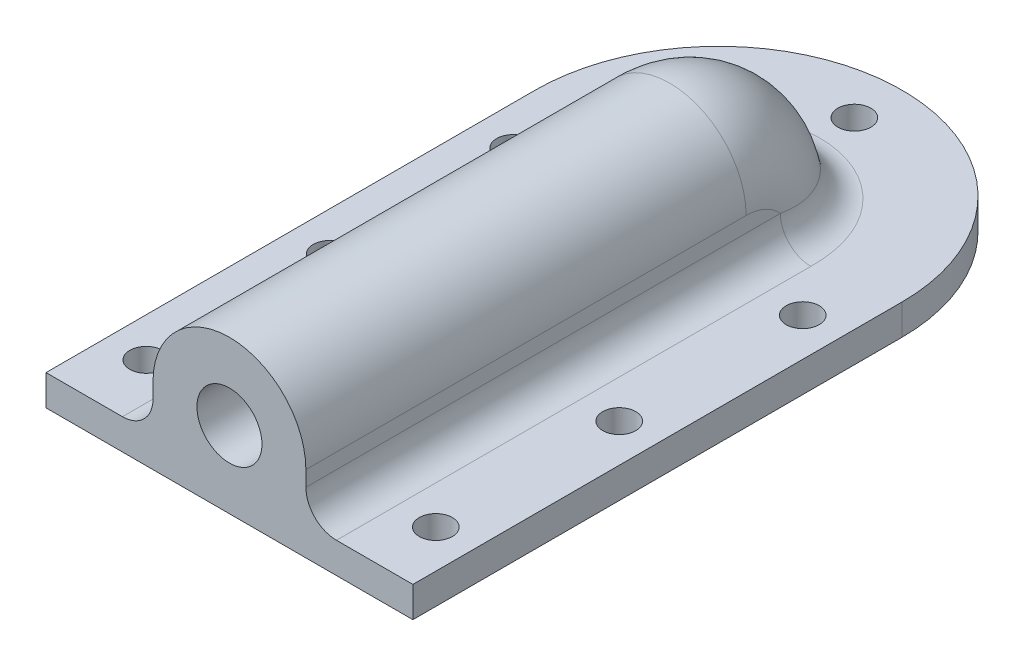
SolidWorks part; units mm, degrees
ref_plane "Front Plane" through (0, 0, 0) normal (0, 0, 1) x (1, 0, 0)
ref_plane "Top Plane" through (0, 0, 0) normal (0, 1, 0) x (1, 0, 0)
ref_plane "Right Plane" through (0, 0, 0) normal (1, 0, 0) x (0, 0, -1)
sketch "Sketch2" plane through (0, 0, 0) normal (0, 1, 0) x (1, 0, 0)
  line L2 (-19.05, 25.4) -> (-19.05, -25.4)
  line L3 (-19.05, -25.4) -> (19.05, -25.4)
  line L4 (19.05, 25.4) -> (19.05, -25.4)
  line L5 (-19.05, 25.4) -> (19.05, -25.4) construction
  line L6 (-19.05, -25.4) -> (19.05, 25.4) construction
  arc A0 (19.05, 25.4) -> (-19.05, 25.4) centre (0, 25.4) ccw
  point P0 (0, 0)
  dimension "D1" = 38.1
  dimension "D2" = 50.8
extrude "Boss-Extrude1" add sketch "Sketch2" along normal blind 3.175
sketch "Sketch3" plane through (0, 0, 25.4) normal (0, 0, 1) x (1, 0, 0)
  line L0 (-7.9375, 7.9375) -> (-7.9375, 3.175)
  line L1 (-19.05, 3.175) -> (19.05, 3.175) construction
  line L2 (7.9375, 7.9375) -> (7.9375, 3.175)
  line L3 (7.9375, 3.175) -> (-7.9375, 3.175)
  circle A0 centre (0, 7.9375) radius 3.377
  arc A1 (7.9375, 7.9375) -> (-7.9375, 7.9375) centre (0, 7.9375) ccw
  dimension "D1" = 6.754
  dimension "D2" = 7.9375
extrude "Boss-Extrude2" add sketch "Sketch3" against normal blind 45.72
sketch "Sketch4" plane through (0, 0, -20.32) normal (0, 0, -1) x (-1, 0, 0)
  line L0 (-7.9375, 7.9375) -> (-7.9375, 3.175)
  line L1 (19.05, 3.175) -> (-19.05, 3.175) construction
  line L2 (-7.9375, 3.175) -> (7.9375, 3.175)
  line L3 (7.9375, 3.175) -> (7.9375, 7.9375)
  arc A1 (7.9375, 7.9375) -> (-7.9375, 7.9375) centre (0, 7.9375) ccw
revolve "Revolve1" add sketch "Sketch4" angle 90 about L2
fillet "Fillet1" radius 3.175 3 edges at (0, 3.175, -33.02) (7.9375, 3.175, 0.1588) (-7.9375, 3.175, 0.1588)
sketch "Sketch5" plane through (0, 3.175, 0) normal (0, 1, 0) x (1, 0, 0)
  line L0 (-19.05, 25.4) -> (-19.05, -25.4) construction
  line L1 (-19.05, -25.4) -> (-11.1125, -25.4) construction
  line L2 (11.1125, -25.4) -> (19.05, -25.4) construction
  circle A0 centre (-14.986, -19.05) radius 1.7145
  circle A1 centre (-14.986, 0) radius 1.7145
  circle A2 centre (-14.986, 19.05) radius 1.7145
  circle A3 centre (15.0812, -19.05) radius 1.7145
  circle A4 centre (15.0812, 0) radius 1.7145
  circle A5 centre (15.0812, 19.05) radius 1.7145
  dimension "D1" = 3.429
  dimension "D2" = 3.429
  dimension "D3" = 3.429
  dimension "D9" = 3.429
  dimension "D10" = 3.429
  dimension "D11" = 3.429
  dimension "D4" = 19.05
  dimension "D5" = 19.05
  dimension "D6" = 4.064
  dimension "D7" = 4.064
  dimension "D8" = 4.064
  dimension "D12" = 6.35
  dimension "D13" = 6.35
  dimension "D14" = 19.05
  dimension "D15" = 19.05
extrude "Cut-Extrude1" cut sketch "Sketch5" against normal blind 50.8
sketch "Sketch6" plane through (0, 3.175, 0) normal (0, 1, 0) x (1, 0, 0)
  circle A0 centre (0, 39.497) radius 1.7145
  arc A1 (19.05, 25.4) -> (-19.05, 25.4) centre (0, 25.4) ccw construction
  dimension "D1" = 3.429
  dimension "D2" = 14.097
extrude "Cut-Extrude2" cut sketch "Sketch6" against normal blind 50.8
